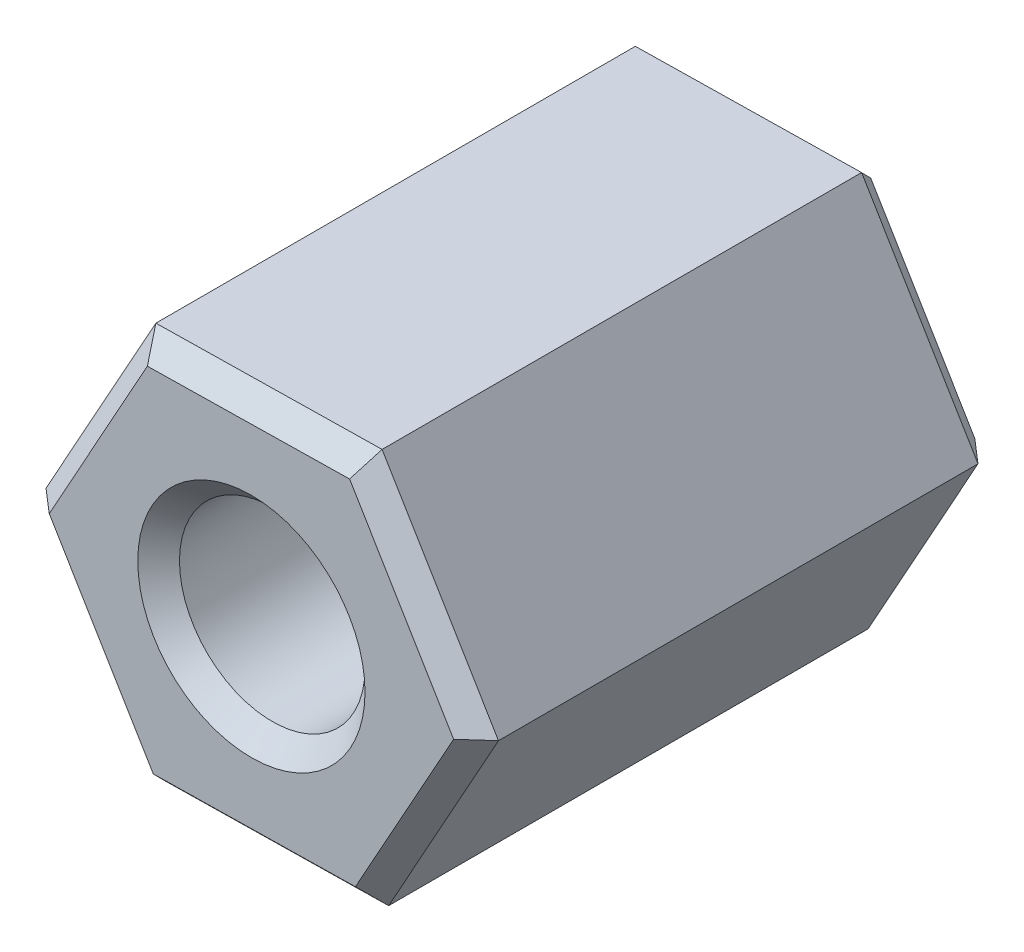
SolidWorks part; units mm, degrees
ref_plane "Front" through (0, 0, 0) normal (0, 0, 1) x (1, 0, 0)
ref_plane "Top" through (0, 0, 0) normal (0, 1, 0) x (1, 0, 0)
ref_plane "Right" through (0, 0, 0) normal (1, 0, 0) x (0, 0, -1)
sketch "Sketch1" plane through (0, 0, 0) normal (0, 0, 1) x (1, 0, 0)
  line L1 (2.7566, 0.0461) -> (1.3383, 2.4103)
  line L2 (1.3383, 2.4103) -> (-1.4182, 2.3642)
  line L3 (-1.4182, 2.3642) -> (-2.7566, -0.0461)
  line L4 (-2.7566, -0.0461) -> (-1.3383, -2.4103)
  line L5 (-1.3383, -2.4103) -> (1.4182, -2.3642)
  line L6 (1.4182, -2.3642) -> (2.7566, 0.0461)
  circle A0 centre (0, 0) radius 2.3876 construction
extrude "Extrude1" add sketch "Sketch1" along normal blind 6.35 contours L1 L2 L3 L4 L5 L6
hole_wizard "#4-40 Tapped Hole1" positions "Sketch3" profile "Sketch2" tap size "#4-40" standard "Ansi Inch"
sketch "Sketch3" plane through (0, 0, 0) normal (0, 0, 1) x (1, 0, 0)
  point P0 (0, 0)
sketch "Sketch2" plane through (0, 0, 0) normal (1, 0, 0) x (0, 1, 0)
  line L0 (0, 0) -> (0, 6.35)
  line L1 (0, 6.35) -> (1.1303, 6.35)
  line L2 (1.1303, 6.35) -> (1.1303, 0)
  line L5 (1.1303, 0) -> (0, 0)
  line L11 (0, -6.35) -> (0, 107.95) construction
  dimension "Thread Major Dia." = 2.2606
  dimension "Thru Tap Drill Depth" = 6.35
chamfer "Chamfer2" distance 0.254 angle 45 6 edges at (0.04, -2.3873, 6.35) (-2.0475, -1.2282, 6.35) (-2.0874, 1.159, 6.35) (-0.04, 2.3873, 6.35) (2.0475, 1.2282, 6.35) (2.0874, -1.159, 6.35)
chamfer "Chamfer3" distance 0.254 angle 45 1 edges at (-1.1303, 0, 6.35)
chamfer "Chamfer4" distance 0.254 angle 45 7 edges at (-1.1303, 0, 0) (-0.04, 2.3873, 0) (2.0475, 1.2282, 0) (2.0874, -1.159, 0) (0.04, -2.3873, 0) (-2.0475, -1.2282, 0) (-2.0874, 1.159, 0)
